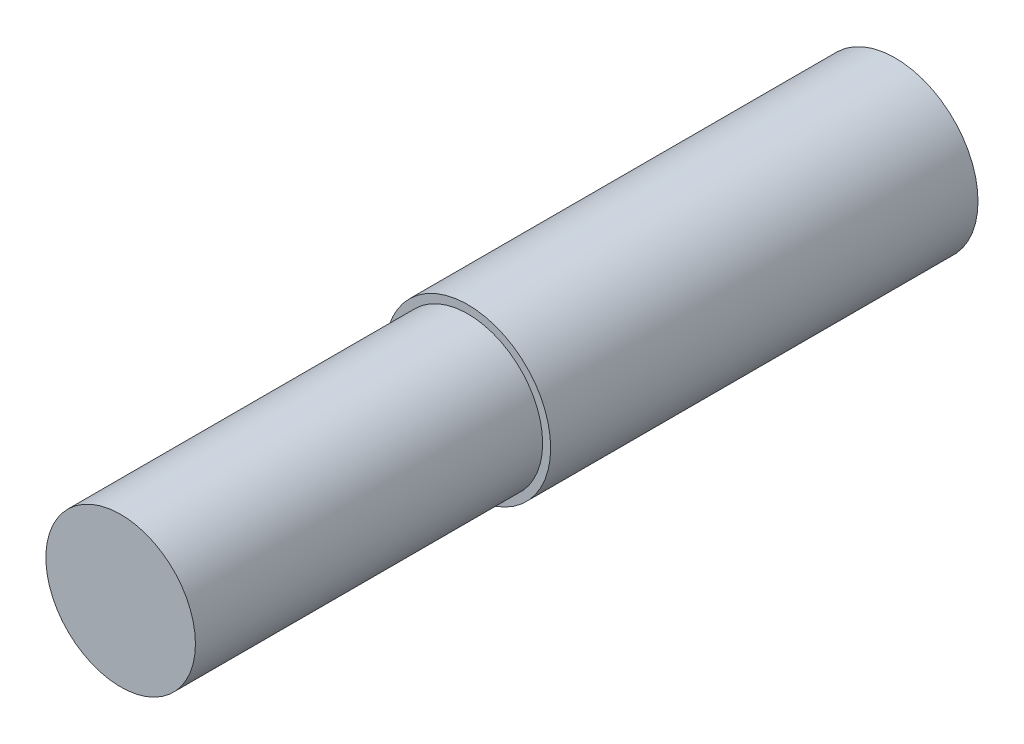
SolidWorks part; units mm, degrees
ref_plane "Front Plane" through (0, 0, 0) normal (0, 0, 1) x (1, 0, 0)
ref_plane "Top Plane" through (0, 0, 0) normal (0, 1, 0) x (1, 0, 0)
ref_plane "Right Plane" through (0, 0, 0) normal (1, 0, 0) x (0, 0, -1)
sketch "Sketch1" plane through (0, 0, 0) normal (0, 0, 1) x (1, 0, 0)
  circle A0 centre (0, 0) radius 15.5
  dimension "D1" = 31
extrude "Boss-Extrude1" add sketch "Sketch1" along normal blind 80
sketch "Sketch2" plane through (0, 0, 80) normal (0, 0, 1) x (1, 0, 0)
  circle A0 centre (0, 0) radius 14
  dimension "D1" = 28
extrude "Boss-Extrude2" add sketch "Sketch2" along normal blind 65
